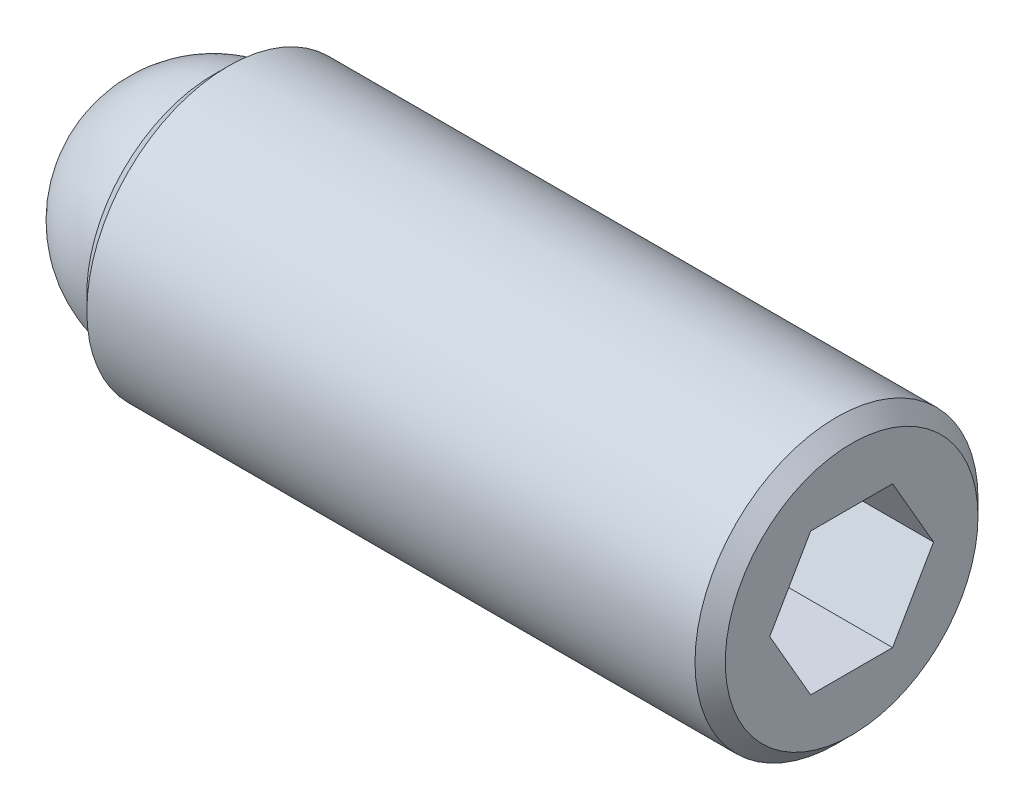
SolidWorks part; units mm, degrees
ref_plane "Front Plane" through (0, 0, 0) normal (0, 0, 1) x (1, 0, 0)
ref_plane "Top Plane" through (0, 0, 0) normal (0, 1, 0) x (1, 0, 0)
ref_plane "Right Plane" through (0, 0, 0) normal (1, 0, 0) x (0, 0, -1)
sketch "Sketch2" plane through (0, 0, 0) normal (1, 0, 0) x (0, 0, -1)
  circle A0 centre (0, 0) radius 2.3749
  dimension "D1" = 4.7498
extrude "Boss-Extrude1" add sketch "Sketch2" along normal blind 10.7156
sketch "Sketch3" plane through (0, 0, 0) normal (-1, 0, 0) x (0, 0, 1)
  circle A0 centre (0, 0) radius 1.9812
  dimension "D1" = 3.9624
chamfer "Chamfer1" distance 0.254 angle 45 1 edges at (0, 0, -2.3749)
chamfer "Chamfer2" distance 0.254 angle 45 1 edges at (10.7156, 0, -2.3749)
sketch "Sketch4" plane through (10.7156, 0, 0) normal (1, 0, 0) x (0, 0, -1)
  line L1 (1.3748, 0) -> (0.6874, 1.1906)
  line L2 (0.6874, 1.1906) -> (-0.6874, 1.1906)
  line L3 (-0.6874, 1.1906) -> (-1.3748, 0)
  line L4 (-1.3748, 0) -> (-0.6874, -1.1906)
  line L5 (-0.6874, -1.1906) -> (0.6874, -1.1906)
  line L6 (0.6874, -1.1906) -> (1.3748, 0)
  circle A0 centre (0, 0) radius 1.1906 construction
  dimension "D1" = 2.3813
extrude "Cut-Extrude2" cut sketch "Sketch4" against normal blind 2.286
extrude "Cut-Extrude3" cut sketch "Sketch3" against normal blind 1.9844
sketch "Sketch5" plane through (0, 0, 0) normal (-1, 0, 0) x (0, 0, 1)
  line L0 (0, 0) -> (0, -1.9844)
  line L1 (0, 0) -> (0, 1.9844)
  arc A0 (0, 1.9844) -> (0, -1.9844) centre (0, 0) ccw
  dimension "D1" = 1.9844
revolve "Revolve1" add sketch "Sketch5" angle 360 about L1
